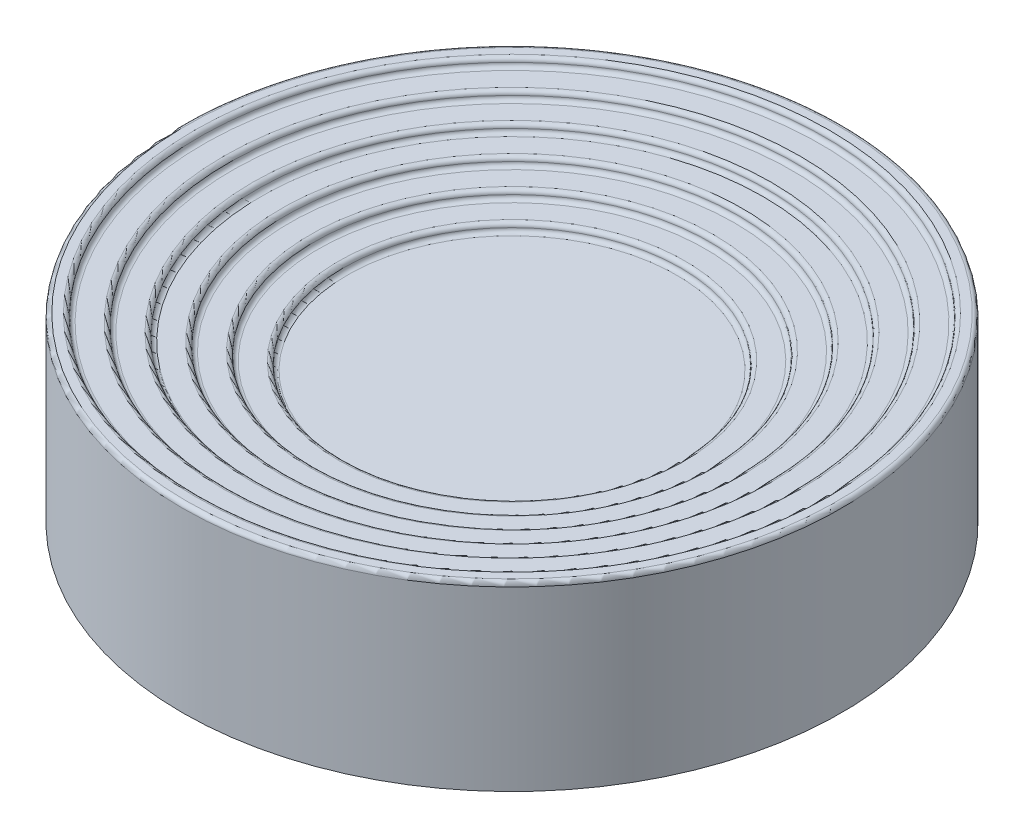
SolidWorks part; units mm, degrees
ref_plane "Płaszczyzna przednia" through (0, 0, 0) normal (0, 0, 1) x (1, 0, 0)
ref_plane "Płaszczyzna górna" through (0, 0, 0) normal (0, 1, 0) x (1, 0, 0)
ref_plane "Płaszczyzna prawa" through (0, 0, 0) normal (1, 0, 0) x (0, 0, -1)
sketch "Szkic2" plane through (0, 0, 0) normal (0, 0, 1) x (1, 0, 0)
  line L0 (0, 0) -> (80, 0)
  line L1 (80, 0) -> (80, 44)
  line L2 (80, 44) -> (76, 44)
  line L3 (0, 0) -> (0, 32)
  line L4 (0, 32) -> (41, 32)
  line L5 (41, 32) -> (41, 34)
  line L6 (41, 34) -> (48, 34)
  line L7 (48, 34) -> (48, 36)
  line L8 (48, 36) -> (55, 36)
  line L9 (55, 36) -> (55, 38)
  line L10 (55, 38) -> (62, 38)
  line L11 (62, 38) -> (62, 40)
  line L12 (62, 40) -> (69, 40)
  line L13 (69, 40) -> (69, 42)
  line L14 (69, 42) -> (76, 42)
  line L15 (76, 42) -> (76, 44)
  point P16 (76, 44.4839)
revolve "Obrót1" add sketch "Szkic2" angle 360 about L3
fillet "Zaokrąglenie1" radius 1 13 edges at (0, 32, -41) (0, 34, -41) (0, 34, -48) (0, 36, -48) (0, 36, -55) (0, 38, -55) (0, 38, -62) (0, 40, -62) (0, 40, -69) (0, 42, -69) (0, 42, -76) (0, 44, -76) (0, 44, -80)
sketch "Szkic3" plane through (0, 0, 0) normal (0, -1, 0) x (1, 0, 0)
  circle A0 centre (0, 0) radius 72
  circle A1 centre (0, 0) radius 80 construction
  dimension "D1" = 8
extrude "Wytnij-wyciągnięcie1" cut sketch "Szkic3" against normal blind 27
sketch "Szkic4" plane through (0, 32, 0) normal (0, 1, 0) x (1, 0, 0)
  circle A0 centre (0, 0) radius 15
extrude "Wytnij-wyciągnięcie2" [suppressed] cut sketch "Szkic4" against normal blind 27
